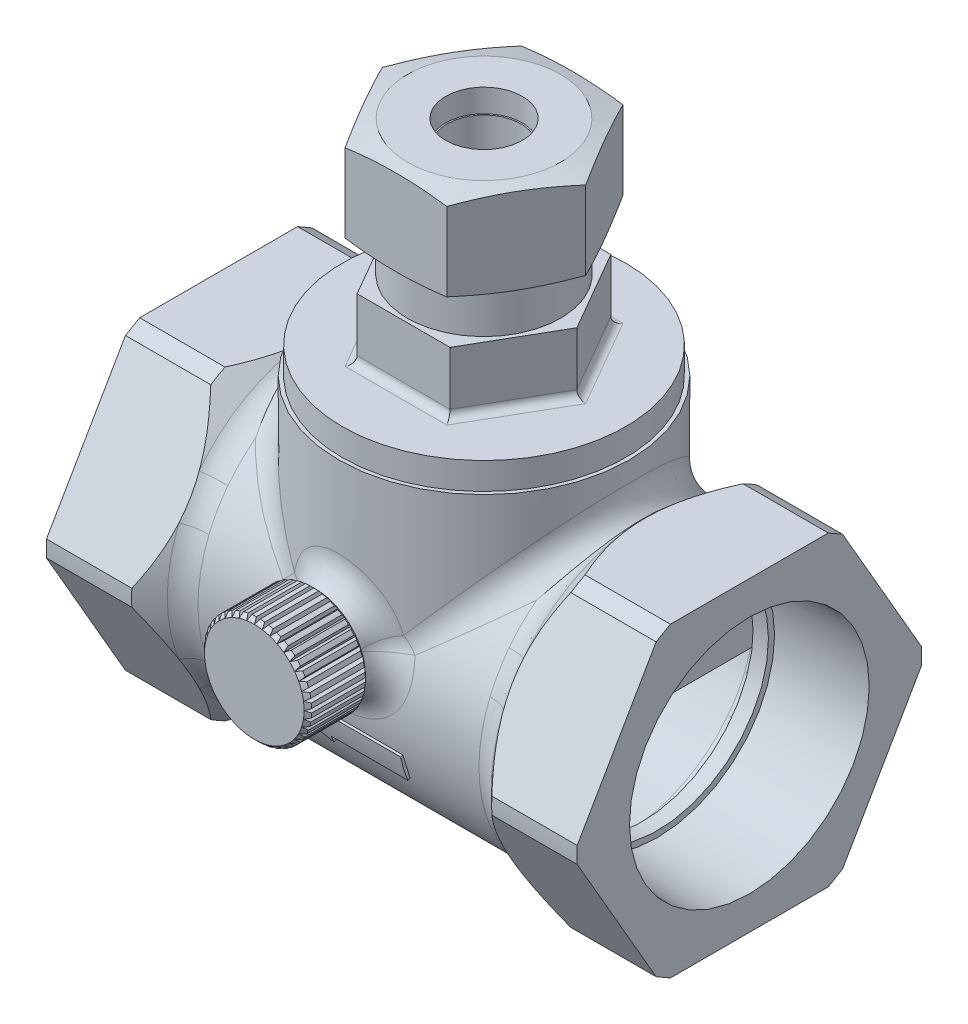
SolidWorks part; units mm, degrees
ref_plane "Front Plane" through (0, 0, 0) normal (0, 0, 1) x (1, 0, 0)
ref_plane "Top Plane" through (0, 0, 0) normal (0, 1, 0) x (1, 0, 0)
ref_plane "Right Plane" through (0, 0, 0) normal (1, 0, 0) x (0, 0, -1)
imported_body "STOP & WASTE-1-1-solid1"
imported_body "STOP & WASTE-3-1-solid1"
imported_body "STOP & WASTE-2-1-solid1"
imported_body "STOP & WASTE-4-1-solid1"
imported_body "STOP & WASTE-7-1-solid1"
imported_body "STOP & WASTE-9-1-solid1"
sketch "Sketch1" plane through (0, 43.4245, 0) normal (0, 1, 0) x (1, 0, 0)
  circle A0 centre (0, 0) radius 33.9161
extrude "Cut-Extrude1" cut sketch "Sketch1" along normal blind 31
